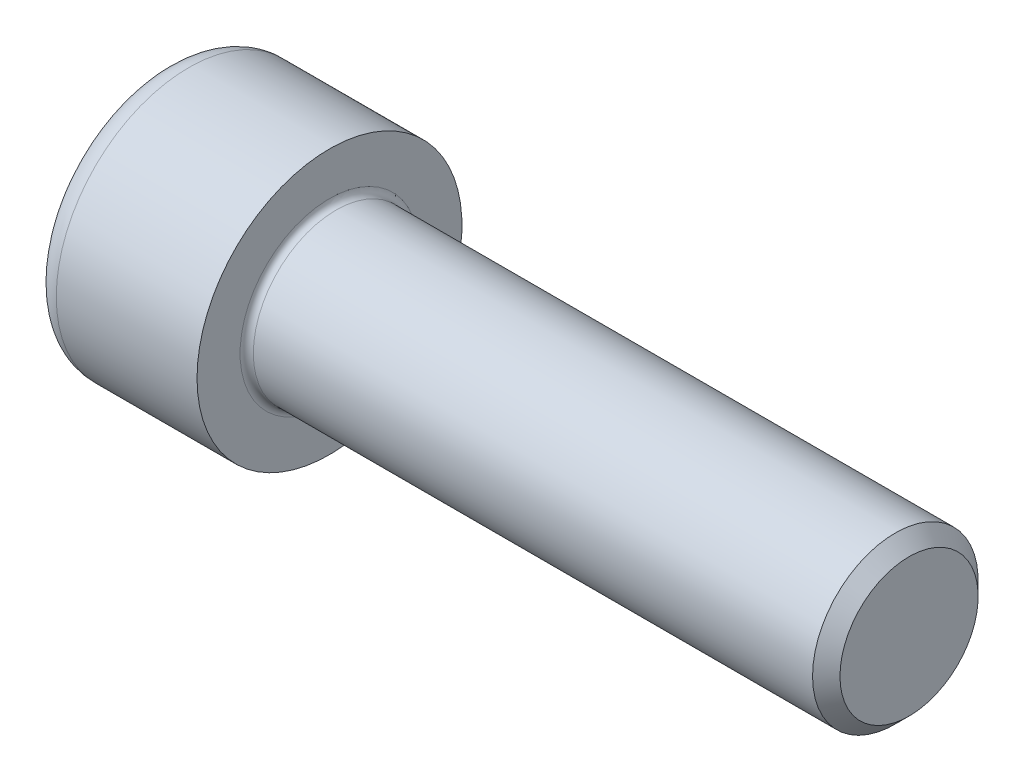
SolidWorks part; units mm, degrees
ref_plane "Plane1" through (0, 0, 0) normal (0, 0, 1) x (1, 0, 0)
ref_plane "Plane2" through (0, 0, 0) normal (0, 1, 0) x (1, 0, 0)
ref_plane "Plane3" through (0, 0, 0) normal (1, 0, 0) x (0, 0, -1)
sketch "BodySke" plane through (0, 0, 0) normal (0, 0, 1) x (1, 0, 0)
  line L0 (0, 0) -> (0, 8)
  line L1 (0, 8) -> (10, 8)
  line L2 (10, 8) -> (10, 5)
  line L3 (10, 5) -> (44.172, 5)
  line L4 (45, 4.172) -> (45, 0)
  line L5 (45, 0) -> (0, 0)
  line L6 (-31.75, 0) -> (127, 0) construction
  line L8 (45, 4.172) -> (44.172, 5)
  line L10 (45, -4.172) -> (44.172, -5) construction
  line L11 (11.5, 9.525) -> (11.5, 3.175) construction
  line L12 (10, 9.525) -> (10, 3.175) construction
  line L13 (-15, 9.525) -> (-15, 3.175) construction
  dimension "Diameter" = 10
  dimension "Head_ht" = 10
  dimension "Length" = 35
  dimension "Body_ch_ang" = 45
  dimension "Head_dia" = 16
  dimension "Minor_dia" = 8.344
  dimension "Advance" = 1.5
  dimension "Thread_nom" = 35
  dimension "Thread_length" = 60
revolve "Base-Revolve" add sketch "BodySke"
fillet "Fillet1" radius 0.4
fillet "Fillet2" radius 1.5
sketch "Sketch2" plane through (0, 0, 0) normal (0, 0, 1) x (1, 0, 0)
  line L0 (0, 4.0575) -> (5, 4.0575)
  line L1 (5, 4.0575) -> (7.3426, 0)
  line L2 (-31.75, 0) -> (127, 0) construction
  line L3 (7.3426, 0) -> (0, 0)
  line L4 (0, 0) -> (0, 4.0575)
  line L6 (0, 0) -> (47.625, 0) construction
  dimension "D1" = 4.0575
  dimension "D2" = 60
  dimension "Depth" = 5
revolve "Hex-PreBroach" cut sketch "Sketch2" angle 360 about L6
sketch "Sketch3" plane through (0, 0, 0) normal (-1, 0, 0) x (0, 0.5, 0.866)
  line L0 (2.3426, 4.0575) -> (-2.3426, 4.0575)
  line L1 (-2.3426, 4.0575) -> (-4.6852, 0)
  line L2 (2.3426, 4.0575) -> (4.6852, 0)
  line L3 (2.3426, -4.0575) -> (4.6852, 0)
  line L4 (2.3426, -4.0575) -> (-2.3426, -4.0575)
  line L5 (-2.3426, -4.0575) -> (-4.6852, 0)
  dimension "D1" = 4.0575
  dimension "D2" = 4.0575
  dimension "Hex_size" = 8.115
extrude "Hex" cut sketch "Sketch3" against normal blind 5
sketch "ThdSchSke" plane through (0, 0, 0) normal (0, 0, 1) x (1, 0, 0)
  line L0 (14.5, -4.172) -> (13.9202, -5)
  line L1 (14.5, -4.172) -> (15.0798, -5)
  line L2 (15.0798, -5) -> (15.0798, -6.25)
  line L3 (-3.175, 0) -> (5.1513, 0) construction
  line L4 (0, 6.5) -> (0, -6.5) construction
  line L5 (15.0798, -6.25) -> (13.9202, -6.25)
  line L6 (13.9202, -6.25) -> (13.9202, -5)
  dimension "Thread_minor" = 8.344
  dimension "Diameter" = 10
  dimension "Start" = 14.5
  dimension "SideAngle" = 55
  dimension "VeeAngle" = 70
  dimension "Overcut" = 12.5
revolve "ThreadSchematic" [suppressed] cut sketch "ThdSchSke" angle 360 about L3
pattern_linear "ThdSchPat" [suppressed]
equation "\"D2@Sketch3\" = \"Hex_size@Sketch3\" / 2"
equation "\"D1@Sketch3\" = \"Hex_size@Sketch3\" / 2"
equation "\"D1@Sketch2\" = \"Hex_size@Sketch3\" / 2"
equation "\"Thread_minor@ThreadCosmetic\"  =  \"Minor_dia@BodySke\""
equation "\"Depth@Sketch2\" =  \"Key_eng@Hex\""
equation "\"Thread_length@ThreadCosmetic\" = ((sgn( (\"Length@BodySke\" - \"Advance@BodySke\" * 3.0) - \"Thread_nom@BodySke\" )-1)*( (\"Length@BodySke\" - \"Advance@BodySke\" * 3.0) - \"Thread_nom@BodySke\" ))/-2+ \"Thread_no"
equation "\"Thread_minor@ThdSchSke\" = \"Minor_dia@BodySke\""
equation "\"Diameter@ThdSchSke\" = \"Diameter@BodySke\""
equation "\"Overcut@ThdSchSke\" = \"Diameter@BodySke\" * 1.25"
equation "\"Start@ThdSchSke\" = \"Head_ht@BodySke\" + \"Length@BodySke\" - \"Thread_length@ThreadCosmetic\"  '---Non-countersunk---"
equation "\"Num_threads@ThdSchPat\" = int( \"Thread_length@ThreadCosmetic\" / \"Advance@BodySke\" + 0.999 )  + 1"
equation "\"Advance@ThdSchPat\" = \"Thread_length@ThreadCosmetic\" /  (\"Num_threads@ThdSchPat\" - 1) 'relax it"
equation "\"Num_threads@ThdSchPat\" = \"Num_threads@ThdSchPat\" - sgn( \"Num_threads@ThdSchPat\" - 1) '---chamfered tips only---"
